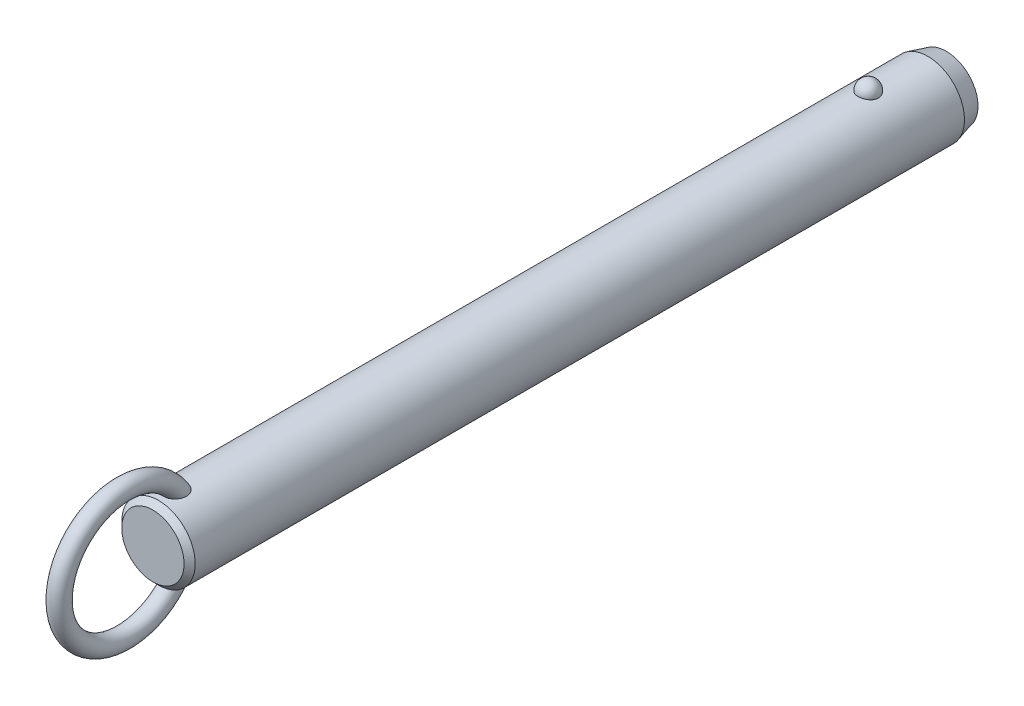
SolidWorks part; units mm, degrees
ref_plane "Front Plane" through (0, 0, 0) normal (0, 0, 1) x (1, 0, 0)
ref_plane "Top Plane" through (0, 0, 0) normal (0, 1, 0) x (1, 0, 0)
ref_plane "Right Plane" through (0, 0, 0) normal (1, 0, 0) x (0, 0, -1)
sketch "Sketch2" plane through (0, 0, 0) normal (0, 0, 1) x (1, 0, 0)
  circle A0 centre (0, 0) radius 7.9
  point P3 (0, 7.9)
  dimension "D1" = 15.8
extrude "Boss-Extrude1" add sketch "Sketch2" along normal blind 142.2
sketch "Sketch3" plane through (0, 0, 0) normal (0, 0, -1) x (-1, 0, 0)
  circle A0 centre (0, 0) radius 7.9
  dimension "D1" = 15.8
extrude "Boss-Extrude2" add sketch "Sketch3" along normal blind 19
chamfer "Chamfer1" distance 4 angle 15 1 edges at (-7.9, 0, -19)
sketch "Sketch12" plane through (0, 0, 0) normal (1, 0, 0) x (0, 0, -1)
  line L0 (-142.2, 7.9) -> (-142.2, -7.9) construction
  point P0 (-142.2, 0)
sketch "Sketch13" plane through (0, 0, 0) normal (1, 0, 0) x (0, 0, -1)
  circle A0 centre (-158.05, 0) radius 15.85
  point P2 (-142.2, 0)
  dimension "D1" = 31.7
sketch "Sketch14" plane through (0, 0, 0) normal (0, 1, 0) x (1, 0, 0)
  circle A0 centre (0, -144.2) radius 2
  point P2 (0, -142.2)
  dimension "D1" = 4
sweep "Sweep1" add profiles "Sketch14" path "Sketch13"
sketch "Sketch15" plane through (0, 0, 142.2) normal (0, 0, 1) x (1, 0, 0)
  circle A0 centre (0, 0) radius 7.9
  dimension "D1" = 15.8
extrude "Boss-Extrude3" add sketch "Sketch15" along normal blind 9.52
chamfer "Chamfer2" distance 1.2 angle 45 1 edges at (7.9, 0, 151.72)
sketch "Sketch18" plane through (0, 0, 0) normal (1, 0, 0) x (0, 0, -1)
  line L0 (15, 7.9) -> (-144.3091, 7.9) construction
  line L1 (2.2, 10.1) -> (2.2, 5.7)
  line L2 (-144.3091, -7.9) -> (15, -7.9) construction
  arc A0 (2.2, 10.1) -> (2.2, 5.7) centre (2.2, 7.9) ccw
  point P4 (0, 7.9)
  dimension "D1" = 18
revolve "Revolve1" add sketch "Sketch18" angle 360 about L1
